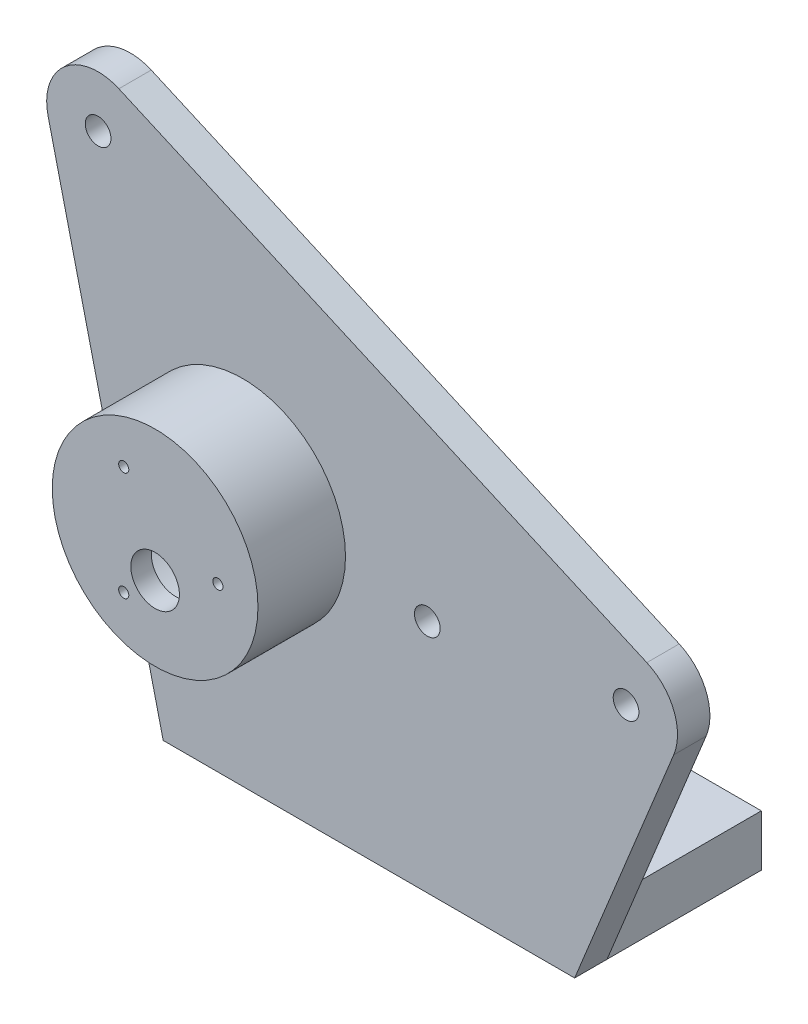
SolidWorks part; units mm, degrees
ref_plane "Front Plane" through (0, 0, 0) normal (0, 0, 1) x (1, 0, 0)
ref_plane "Top Plane" through (0, 0, 0) normal (0, 1, 0) x (1, 0, 0)
ref_plane "Right Plane" through (0, 0, 0) normal (1, 0, 0) x (0, 0, -1)
sketch "Sketch1" plane through (0, 0, 0) normal (0, 0, 1) x (1, 0, 0)
  line L0 (-130.3782, 57.531) -> (-130.3782, 0) construction
  line L1 (-130.3782, 0) -> (0, 0) construction
  line L8 (5.1271, 11.6191) -> (-125.2511, 69.1501)
  line L9 (-142.7324, 54.5875) -> (-114.3, -64.7446)
  line L10 (-114.3, -64.7446) -> (-12.7, -64.7446)
  line L11 (-12.7, -64.7446) -> (11.7589, -4.7977)
  circle A2 centre (-130.3782, 57.531) radius 3.175
  circle A4 centre (0, 0) radius 3.175
  arc A8 (-125.2511, 69.1501) -> (-142.7324, 54.5875) centre (-130.3782, 57.531) ccw
  arc A9 (11.7589, -4.7977) -> (5.1271, 11.6191) centre (0, 0) ccw
  dimension "D4" = 12.7
  dimension "D7" = 6.35
  dimension "D1" = 130.3782
  dimension "D2" = 57.531
  dimension "D3" = 64.7446
  dimension "D5" = 101.6
  dimension "D6" = 12.7
extrude "Boss-Extrude1" add sketch "Sketch1" along normal mid plane 8
sketch "Sketch3" plane through (0, 0, -4) normal (0, 0, -1) x (-1, 0, 0)
  line L0 (12.7, -64.7446) -> (-11.7589, -4.7977) construction
  line L1 (12.7, -64.7446) -> (114.3, -64.7446)
  line L2 (12.7, -64.7446) -> (12.7, -52.0446)
  line L3 (12.7, -52.0446) -> (114.3, -52.0446)
  line L4 (114.3, -64.7446) -> (114.3, -52.0446)
  line L5 (114.3, -64.7446) -> (12.7, -64.7446) construction
  dimension "D1" = 12.7
extrude "Boss-Extrude3" add sketch "Sketch3" along normal blind 38.1
sketch "Sketch4" plane through (0, 0, -4) normal (0, 0, -1) x (-1, 0, 0)
  circle A0 centre (49.0817, -6.6489) radius 3.175 construction
  circle A1 centre (49.0817, -6.6489) radius 3.175
  circle A3 centre (94.6852, -2.9113) radius 20.32
  dimension "D1" = 40.64
extrude "Cut-Extrude1" cut sketch "Sketch4" against normal up to surface (8 mm away)
sketch "Sketch5" plane through (0, 0, 4) normal (0, 0, 1) x (1, 0, 0)
  circle A1 centre (-94.6852, -2.9113) radius 20.32 construction
  circle A2 centre (-94.6852, -2.9113) radius 25.4
  circle A3 centre (-94.6852, -2.9113) radius 25.4
  circle A4 centre (-94.6852, -2.9113) radius 20.32
  dimension "D1" = 5.08
extrude "Boss-Extrude4" add sketch "Sketch5" along normal up to surface (16.5338 mm away)
sketch "Sketch6" plane through (0, 0, 20.5338) normal (0, 0, 1) x (1, 0, 0)
  circle A0 centre (-94.6852, -2.9113) radius 25.4 construction
  circle A1 centre (-102.4352, -16.3347) radius 1.25
  circle A3 centre (-102.4352, 10.5121) radius 1.25
  circle A5 centre (-79.1852, -2.9113) radius 1.25
  circle A7 centre (-94.6852, -9.9113) radius 6
  circle A9 centre (-94.6852, -2.9113) radius 25.4
extrude "Boss-Extrude5" add sketch "Sketch6" along normal blind 5.08
sketch "Sketch7" plane through (0, -64.7446, 0) normal (0, -1, 0) x (1, 0, 0)
  line L1 (-12.7, -42.1) -> (-12.7, -4) construction
  circle A0 centre (-19.304, -8.572) radius 2.54
  circle A1 centre (-44.196, -33.464) radius 2.54
  dimension "D1" = 5.08
  dimension "D2" = 24.892
  dimension "D3" = 33.528
  dimension "D4" = 6.604
  dimension "D5" = 24.892
extrude "Cut-Extrude2" cut sketch "Sketch7" against normal up to surface (12.7 mm away)
